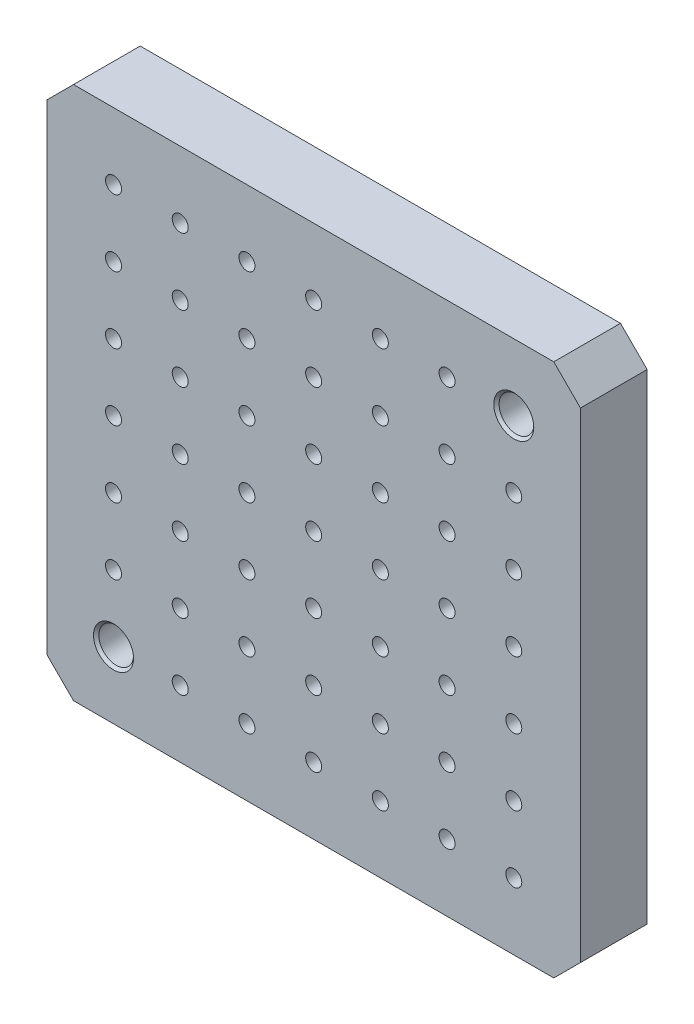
SolidWorks part; units mm, degrees
ref_plane "Plan1" through (0, 0, 0) normal (0, 0, 1) x (1, 0, 0)
ref_plane "Plan2" through (0, 0, 0) normal (0, 1, 0) x (1, 0, 0)
ref_plane "Plan3" through (0, 0, 0) normal (1, 0, 0) x (0, 0, -1)
sketch "Esquisse1" plane through (0, 0, 0) normal (0, 0, 1) x (1, 0, 0)
  line L0 (0, 0) -> (200, 0)
  line L1 (200, 0) -> (200, 200)
  line L2 (200, 200) -> (0, 200)
  line L3 (0, 200) -> (0, 0)
  dimension "D1" = 200
  dimension "D2" = 200
extrude "Base-Extrusion" add sketch "Esquisse1" along normal blind 25
chamfer "Chanfrein1" distance 10 angle 45
sketch "Esquisse3" plane through (0, 0, 0) normal (0, 0, 1) x (1, 0, 0)
  line L0 (10, 25) -> (40, 25) construction
  line L1 (25, 60) -> (25, -10) construction
  circle A0 centre (25, 25) radius 3
  dimension "D3" = 6
  dimension "D1" = 25
  dimension "D2" = 25
extrude "Enlèv. mat.-Extru.2" cut sketch "Esquisse3" along normal blind 25
sketch "Esquisse4" plane through (0, 0, 0) normal (0, 0, 1) x (1, 0, 0)
  circle A0 centre (25, 25) radius 6
  dimension "D1" = 12
extrude "Enlèv. mat.-Extru.4" cut sketch "Esquisse4" along normal blind 4.5
pattern_linear "Répétition linéaire1" count 7 spacing 25
pattern_linear "Répétition linéaire2" count 7 spacing 25
sketch "Esquisse5" plane through (0, 0, 0) normal (0, 0, 1) x (1, 0, 0)
  circle A1 centre (175, 175) radius 6.5
  dimension "D2" = 13
extrude "Enlèv. mat.-Extru.6" cut sketch "Esquisse5" along normal through all
chamfer "Chanfrein2" distance 1 angle 45
sketch "Esquisse6" plane through (0, 0, 0) normal (0, 0, 1) x (1, 0, 0)
  circle A0 centre (175, 175) radius 12.5
  dimension "D1" = 25
extrude "Enlèv. mat.-Extru.8" cut sketch "Esquisse6" along normal blind 5
chamfer "Chanfrein3" distance 1 angle 45
pattern_linear "Répétition linéaire3" count 2 spacing 150 count 2 spacing 150
